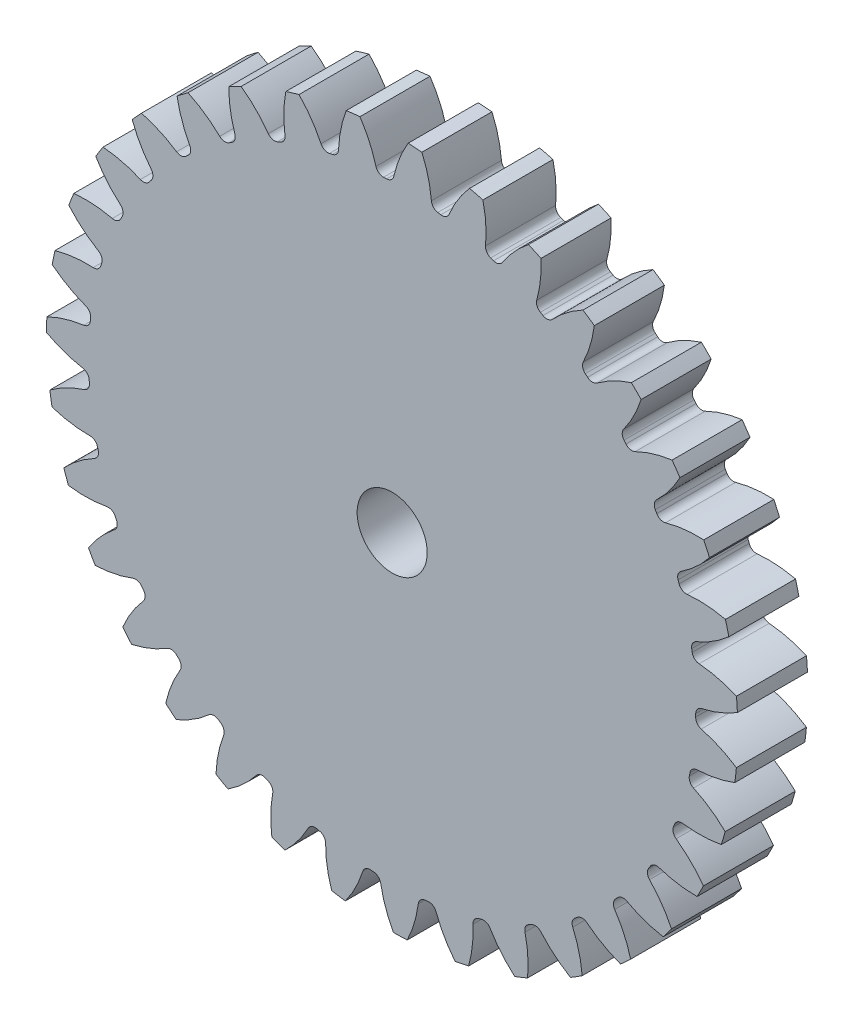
SolidWorks part; units mm, degrees
ref_plane "Front" through (0, 0, 0) normal (0, 0, 1) x (1, 0, 0)
ref_plane "Top" through (0, 0, 0) normal (0, 1, 0) x (1, 0, 0)
ref_plane "Right" through (0, 0, 0) normal (1, 0, 0) x (0, 0, -1)
sketch "Sketch3" plane through (0, 0, 0) normal (0, 0, 1) x (1, 0, 0)
  circle A0 centre (0, 0) radius 626.5333
  dimension "od" = 1253.0667
extrude "gearBody" add sketch "Sketch3" along normal blind 127
sketch "Sketch2" plane through (0, 0, 0) normal (0, 0, 1) x (1, 0, 0)
  line L0 (0, 0) -> (514.5311, 213.1258) construction
  line L1 (624.6517, -57.4808) -> (0, 0) construction
  line L2 (0, 0) -> (36.3143, 0) construction
  line L3 (592.5042, 13.8755) -> (591.3752, -39.1036) construction
  line L5 (591.9397, -12.6141) -> (0, 0) construction
  line L7 (0, 0) -> (556.9245, 0) construction
  arc A0 (556.9141, 3.4018) -> (556.2636, -27.1233) centre (0, 0) ccw construction
  arc A1 (625.7969, 30.368) -> (623.9352, -56.9994) centre (0, 0) ccw construction
  arc A2 (592.5042, 13.8755) -> (591.3752, -39.1036) centre (0, 0) ccw construction
  arc A3 (550.1423, -14.4987) -> (550.2605, -8.9506) centre (0, 0) ccw
  arc A4 (624.6517, -57.4808) -> (560.3543, -28.176) centre (504.9849, -234.8514) ccw
  arc A5 (624.6517, -57.4808) -> (626.5333, 30.8184) centre (0, 0) ccw
  arc A6 (626.5333, 30.8184) -> (561.0459, 4.2793) centre (514.5311, 213.1258) cw
  arc A7 (550.2605, -8.9506) -> (561.0459, 4.2793) centre (564.0425, -9.1748) cw
  arc A8 (560.3543, -28.176) -> (550.1423, -14.4987) centre (563.9213, -14.8618) cw
  point P6 (626.5333, 30.8184)
  point P22 (624.6517, -57.4808)
  dimension "baseDia" = 1113.849
  dimension "od" = 1253.0667
  dimension "pd" = 1185.3333
  dimension "rd" = 1100.6667
  dimension "rFillet" = 13.7837
  dimension "pointX" = 626.5333
  dimension "pointY" = 30.8184
  dimension "CTT" = 52.9791
  dimension "flankCenterAngle" = 22.5
extrude "toothCut" cut sketch "Sketch2" along normal through all
pattern_circular "CirPattern1" count 35 over 360 about axis through (0, 0, 0) along (0, 0, 1) of "toothCut"
sketch "hub1Dia" plane through (0, 0, 0) normal (0, 0, -1) x (-1, 0, 0)
  circle A0 centre (0, 0) radius 12.7
  dimension "hub1Dia" = 25.4
sketch "hub2Dia" plane through (0, 0, 127) normal (0, 0, 1) x (1, 0, 0)
  circle A0 centre (0, 0) radius 12.7
  dimension "hub2dia" = 25.4
sketch "boreDia" plane through (0, 0, 0) normal (0, 0, 1) x (1, 0, 0)
  circle A0 centre (0, 0) radius 63.5
  dimension "boreDia" = 127
extrude "bore" cut sketch "boreDia" against normal mid plane 25400
